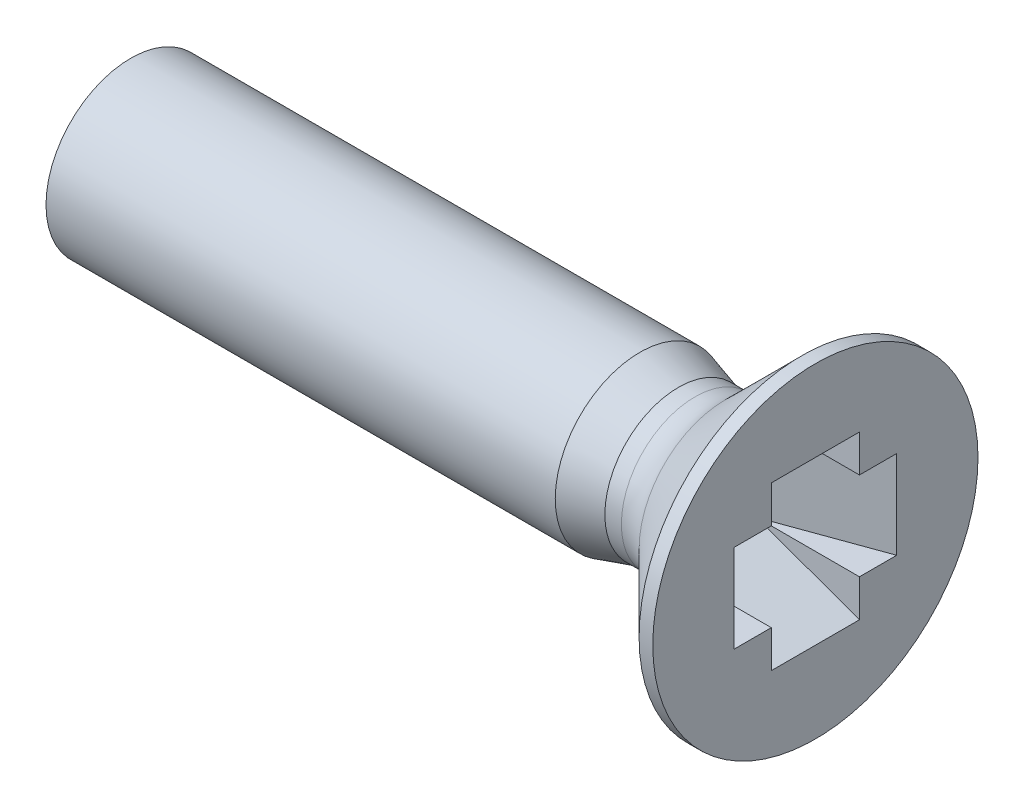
SolidWorks part; units mm, degrees
ref_plane "Plan de face" through (0, 0, 0) normal (0, 0, 1) x (1, 0, 0)
ref_plane "Plan de dessus" through (0, 0, 0) normal (0, 1, 0) x (1, 0, 0)
ref_plane "Plan de droite" through (0, 0, 0) normal (1, 0, 0) x (0, 0, -1)
ref_plane "Plan4" through (0, 0, 0) normal (0, 0, -1) x (-1, 0, 0)
sketch "Esquisse1" plane through (0, 0, 0) normal (0, 0, -1) x (-1, 0, 0)
  line L0 (0, 1.9) -> (0, 0)
  line L1 (0, 0) -> (8, 0)
  line L2 (8, 0) -> (8, 0.99)
  line L3 (8, 0.99) -> (2.0498, 0.99)
  line L4 (2.0498, 0.99) -> (1.6, 0.86)
  line L5 (1.6, 0.86) -> (1.2, 0.86)
  line L6 (1.2, 0.86) -> (0.16, 1.9)
  line L7 (0.16, 1.9) -> (0, 1.9)
  line L8 (0, 0) -> (8, 0) construction
  dimension "D1" = 8
revolve "Révolution1" add sketch "Esquisse1" angle 360 about L8
ref_plane "Plan5" through (0, 0, 0.515) normal (0, 0, 1) x (1, 0, 0)
sketch "Esquisse2" plane through (0, 0, 0.515) normal (0, 0, 1) x (1, 0, 0)
  line L0 (0, -0.95) -> (0, 0.95)
  line L1 (0, 0.95) -> (-1.2, 0.515)
  line L2 (-1.2, 0.515) -> (-1.2, -0.515)
  line L3 (-1.2, -0.515) -> (0, -0.95)
extrude "Extrusion1" cut sketch "Esquisse2" against normal blind 1.03
ref_plane "Plan6" through (0, -0.515, 0) normal (0, -1, 0) x (1, 0, 0)
sketch "Esquisse3" plane through (0, -0.515, 0) normal (0, -1, 0) x (1, 0, 0)
  line L0 (0, 0.515) -> (0, 0.95)
  line L1 (0, 0.95) -> (-1.2, 0.515)
  line L2 (-1.2, 0.515) -> (0, 0.515)
extrude "Extrusion2" cut sketch "Esquisse3" against normal blind 1.03
ref_plane "Plan7" through (0, -0.515, 0) normal (0, -1, 0) x (1, 0, 0)
sketch "Esquisse4" plane through (0, -0.515, 0) normal (0, -1, 0) x (1, 0, 0)
  line L0 (-1.2, -0.515) -> (0, -0.95)
  line L1 (0, -0.95) -> (0, -0.515)
  line L2 (0, -0.515) -> (-1.2, -0.515)
extrude "Extrusion3" cut sketch "Esquisse4" against normal blind 1.03
fillet "Congé1" radius 0.5 1 edges at (-1.2, 0, 0.86)
